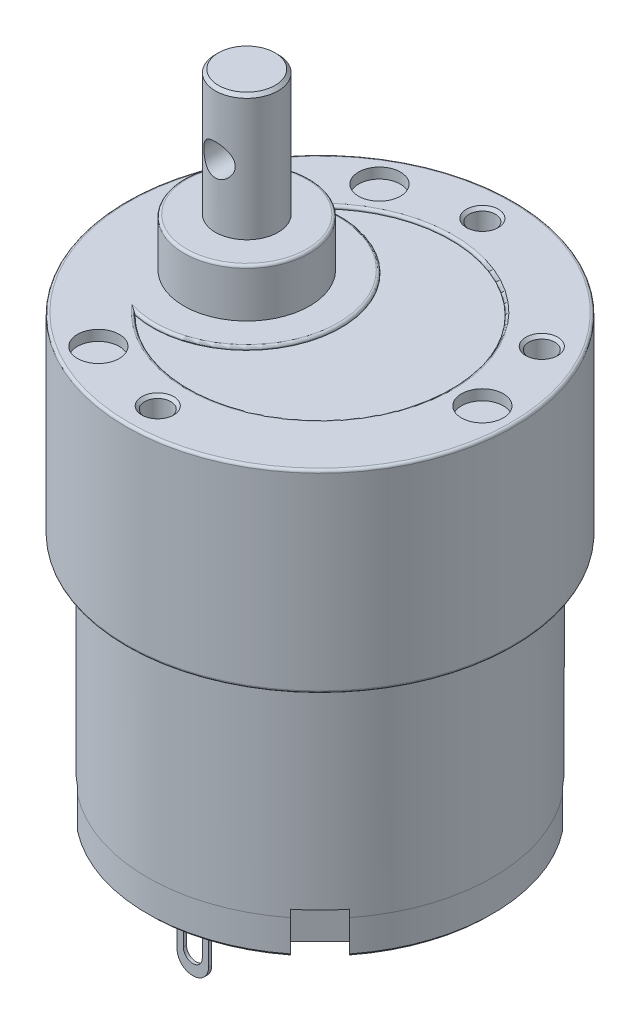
SolidWorks part; units mm, degrees
ref_plane "Front Plane" through (0, 0, 0) normal (0, 0, 1) x (1, 0, 0)
ref_plane "Top Plane" through (0, 0, 0) normal (0, 1, 0) x (1, 0, 0)
ref_plane "Right Plane" through (0, 0, 0) normal (1, 0, 0) x (0, 0, -1)
sketch "Sketch2" plane through (0, 0, 0) normal (0, 1, 0) x (1, 0, 0)
  circle A0 centre (0, 0) radius 18.5
  dimension "D1" = 37
extrude "Boss-Extrude1" add sketch "Sketch2" against normal blind 18.5
sketch "Sketch3" plane through (0, -18.5, 0) normal (0, -1, 0) x (1, 0, 0)
  circle A0 centre (0, 0) radius 16.5
  dimension "D1" = 33
extrude "Boss-Extrude2" add sketch "Sketch3" along normal blind 20
sketch "Sketch4" plane through (0, -38.5, 0) normal (0, -1, 0) x (1, 0, 0)
  circle A1 centre (0, 0) radius 16.5
  circle A2 centre (0, 0) radius 16.5
  dimension "D1" = 0
extrude "Boss-Extrude3" add sketch "Sketch4" along normal blind 3.3 separate body
sketch "Sketch5" plane through (0, 0, 0) normal (0, 1, 0) x (1, 0, 0)
  line L0 (0, 0) -> (-7, 0) construction
  circle A0 centre (-7, 0) radius 6
  dimension "D1" = 7
  dimension "D2" = 12
extrude "Boss-Extrude4" add sketch "Sketch5" along normal blind 4.6
sketch "Sketch6" plane through (0, 4.6, 0) normal (0, 1, 0) x (1, 0, 0)
  circle A0 centre (-7, 0) radius 3
  dimension "D1" = 6
extrude "Boss-Extrude5" add sketch "Sketch6" along normal blind 12
sketch "Sketch7" plane through (0, -41.8, 0) normal (0, -1, 0) x (1, 0, 0)
  line L0 (0, -12) -> (0, 12) construction
  line L1 (0, 0) -> (9.6843, 0) construction
  line L2 (-1.5, 12.15) -> (1.5, 12.15)
  line L3 (-1.5, 12.15) -> (-1.5, 11.85)
  line L4 (-1.5, 11.85) -> (1.5, 11.85)
  line L5 (1.5, 12.15) -> (1.5, 11.85)
  line L6 (-1.5, 12.15) -> (1.5, 11.85) construction
  line L7 (-1.5, 11.85) -> (1.5, 12.15) construction
  line L8 (-1.5, -11.85) -> (1.5, -11.85)
  line L9 (1.5, -12.15) -> (1.5, -11.85)
  line L10 (-1.5, -12.15) -> (1.5, -12.15)
  line L11 (-1.5, -12.15) -> (-1.5, -11.85)
  point P4 (0, 0)
  dimension "D1" = 24
  dimension "D2" = 3
  dimension "D3" = 0.3
extrude "Boss-Extrude6" add sketch "Sketch7" along normal blind 7
fillet "Fillet1" radius 1.45 4 edges at (1.5, -48.8, -12) (-1.5, -48.8, -12) (-1.5, -48.8, 12) (1.5, -48.8, 12)
sketch "Sketch8" plane through (0, 0, 12.15) normal (0, 0, 1) x (1, 0, 0)
  line L0 (0, -46.9) -> (0, -44.9) construction
  line L1 (0, -45.9) -> (0, 0) construction
  line L2 (-0.9, -46.9) -> (-0.9, -44.9)
  line L3 (0.9, -46.9) -> (0.9, -44.9)
  arc A0 (-0.9, -46.9) -> (0.9, -46.9) centre (0, -46.9) ccw
  arc A1 (0.9, -44.9) -> (-0.9, -44.9) centre (0, -44.9) ccw
  point P5 (0, -45.9)
  dimension "D2" = 0.9
  dimension "D3" = 1.9
  dimension "D1" = 2
extrude "Cut-Extrude1" cut sketch "Sketch8" against normal up to surface (24.3 mm away)
sketch "Sketch9" plane through (0, -41.8, 0) normal (0, -1, 0) x (1, 0, 0)
  circle A0 centre (0, 0) radius 3.5
  dimension "D1" = 7
extrude "Boss-Extrude7" add sketch "Sketch9" along normal blind 3
sketch "Sketch10" plane through (0, 0, 0) normal (0, 1, 0) x (1, 0, 0)
  arc A0 (-8.875, -8.8025) -> (-8.875, 8.8025) centre (0, 0) ccw
  circle A1 centre (0, 0) radius 18.5 construction
  arc A2 (-8.875, -8.8025) -> (-8.875, 8.8025) centre (-7, 0) ccw
  circle A3 centre (-7, 0) radius 6 construction
  dimension "D1" = 6
  dimension "D2" = 3
extrude "Cut-Extrude2" cut sketch "Sketch10" against normal blind 0.3
sketch "Sketch11" plane through (0, 0, 0) normal (0, 1, 0) x (1, 0, 0)
  line L0 (0, 0) -> (15.5, 0) construction
  circle A0 centre (15.5, 0) radius 2
  circle A1 centre (-7.75, -13.4234) radius 2
  circle A2 centre (-7.75, 13.4234) radius 2
  point P12 (0, 0)
  dimension "D1" = 15.5
  dimension "D2" = 4
  dimension "D3" = 3
extrude "Cut-Extrude3" cut sketch "Sketch11" against normal blind 1
sketch "Sketch12" plane through (0, 0, 0) normal (0, 1, 0) x (1, 0, 0)
  line L0 (0, 0) -> (0, -15.5) construction
  line L1 (0, 0) -> (-13.4234, 7.75) construction
  line L2 (0, 0) -> (13.4234, 7.75) construction
  line L3 (0, 0) -> (0, 15.5) construction
  point P4 (0, -15.5)
  point P9 (0, 0)
  dimension "D1" = 15.5
  dimension "D2" = 3
hole_wizard "M3x0.5 Tapped Hole2" positions "Sketch15" profile "Sketch16" tap size "M3x0.5" standard "ANSI Metric"
sketch "Sketch15" plane through (0, 0, 0) normal (0, 1, 0) x (1, 0, 0)
  point P0 (0, 15.5)
  point P3 (-13.4234, 7.75)
  point P6 (0, -15.5)
  point P9 (13.4234, 7.75)
sketch "Sketch16" plane through (0, 0, -15.5) normal (1, 0, 0) x (0, 0, 1)
  line L0 (0, 0) -> (0, 17.7511)
  line L1 (0, 17.7511) -> (1.25, 17)
  line L2 (1.25, 17) -> (1.25, 0.275)
  line L3 (1.25, 0.275) -> (1.525, 0)
  line L5 (1.525, 0) -> (0, 0)
  line L6 (-1.25, 0.275) -> (-1.525, 0) construction
  line L10 (0, 17.7511) -> (-1.25, 17) construction
  line L11 (0, -6.35) -> (0, 107.95) construction
  dimension "Tap Drill Dia." = 2.5
  dimension "Tap Drill Depth" = 17
  dimension "Near C'Sink Dia." = 3.05
  dimension "Near C'Sink Angle" = 90
  dimension "Drill Angle" = 118
sketch "Sketch17" plane through (0, 0, 0) normal (0, 0, 1) x (1, 0, 0)
  line L0 (-4, 16.6) -> (-10, 16.6) construction
  line L1 (-4, 16.6) -> (-10, 16.6) construction
  line L2 (-7, 16.6) -> (-7, 10.6) construction
  circle A0 centre (-7, 10.6) radius 1.5
  dimension "D1" = 3
  dimension "D2" = 6
extrude "Cut-Extrude4" cut sketch "Sketch17" against normal through all both and the other way through all
chamfer "Chamfer1" distance 0.3 angle 45 1 edges at (-7, 16.6, 3)
fillet "Fillet2" radius 0.25 5 edges at (0, -18.5, 18.5) (12.5, 0, 0) (2, 0, 0) (0, 0, 18.5) (-7, 4.6, 6)
chamfer "Chamfer2" distance 0.3 angle 45 1 edges at (0, -41.8, -16.5)
sketch "Sketch18" plane through (0, -41.8, 0) normal (0, -1, 0) x (1, 0, 0)
  line L0 (0, 0) -> (0, 16.5) construction
  line L1 (0, 0) -> (13.0815, 13.0815) construction
  line L2 (8.8388, 11.6673) -> (11.6673, 8.8388)
  line L3 (11.6673, 8.8388) -> (14.4957, 11.6673)
  line L4 (14.4957, 11.6673) -> (11.6673, 14.4957)
  line L5 (11.6673, 14.4957) -> (8.8388, 11.6673)
  line L6 (8.8388, 11.6673) -> (14.4957, 11.6673) construction
  line L7 (14.4957, -11.6673) -> (11.6673, -8.8388)
  line L8 (11.6673, -8.8388) -> (8.8388, -11.6673)
  line L9 (8.8388, -11.6673) -> (11.6673, -14.4957)
  line L10 (11.6673, -14.4957) -> (14.4957, -11.6673)
  line L11 (-11.6673, -14.4957) -> (-8.8388, -11.6673)
  line L12 (-8.8388, -11.6673) -> (-11.6673, -8.8388)
  line L13 (-11.6673, -8.8388) -> (-14.4957, -11.6673)
  line L14 (-14.4957, -11.6673) -> (-11.6673, -14.4957)
  line L15 (-14.4957, 11.6673) -> (-11.6673, 8.8388)
  line L16 (-11.6673, 8.8388) -> (-8.8388, 11.6673)
  line L17 (-8.8388, 11.6673) -> (-11.6673, 14.4957)
  line L18 (-11.6673, 14.4957) -> (-14.4957, 11.6673)
  circle A0 centre (0, 0) radius 16.5 construction
  circle A1 centre (0, 0) radius 18.5 construction
  point P12 (11.6673, 11.6673)
  point P29 (0, 0)
  dimension "D1" = 4
  dimension "D2" = 4
  dimension "D3" = 45
  dimension "D4" = 4
extrude "Cut-Extrude5" cut sketch "Sketch18" against normal blind 4
